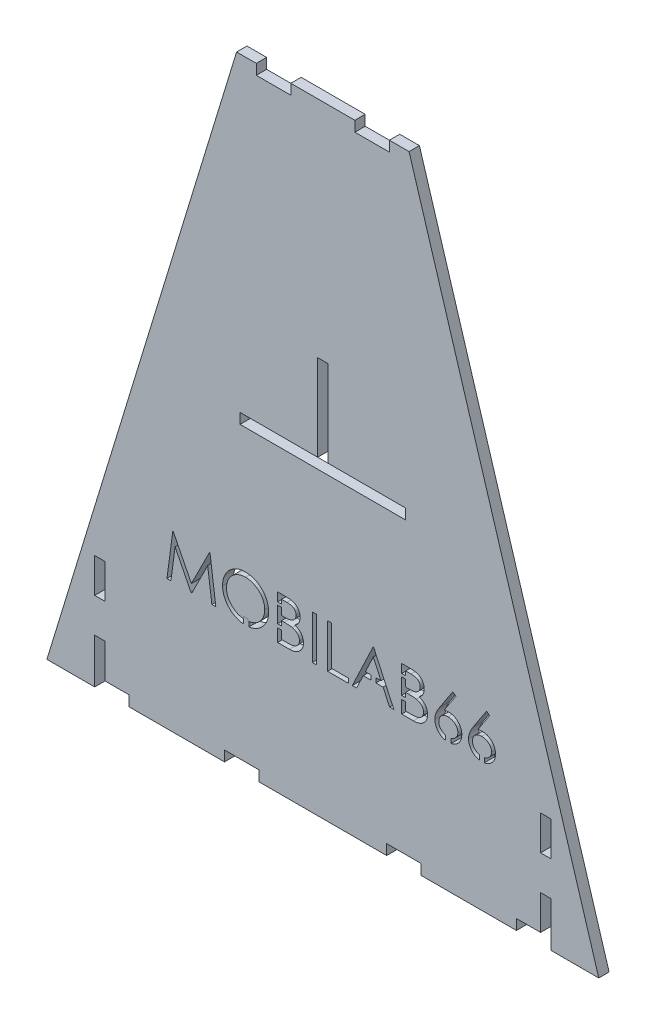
SolidWorks part; units mm, degrees
ref_plane "Plan de face" through (0, 0, 0) normal (0, 0, 1) x (1, 0, 0)
ref_plane "Plan de dessus" through (0, 0, 0) normal (0, 1, 0) x (1, 0, 0)
ref_plane "Plan de droite" through (0, 0, 0) normal (1, 0, 0) x (0, 0, -1)
sketch "Esquisse1" plane through (0, 0, 0) normal (0, 0, 1) x (1, 0, 0)
  line L0 (-80, 5) -> (-66.1305, 5)
  line L1 (-80, 5) -> (-25, 185)
  line L2 (-25, 185) -> (25, 185)
  line L3 (0, 0) -> (0, 132.8404) construction
  line L4 (-1.5, 120) -> (1.5, 120)
  line L5 (-1.5, 120) -> (-1.5, 95)
  line L6 (1.5, 95) -> (24, 95)
  line L7 (1.5, 120) -> (1.5, 95)
  line L8 (80, 5) -> (25, 185)
  line L9 (18.5112, 5) -> (18.5112, 8)
  line L10 (-24, 95) -> (-1.5, 95)
  line L11 (-24, 95) -> (-24, 92)
  line L12 (-24, 92) -> (24, 92)
  line L13 (24, 95) -> (24, 92)
  line L14 (-18.5112, 5) -> (18.5112, 5)
  line L15 (-66.1305, 5) -> (-66.1305, 8)
  line L16 (-66.1305, 8) -> (-56.1305, 8)
  line L17 (-56.1305, 5) -> (-56.1305, 8)
  line L18 (28.5112, 5) -> (56.1305, 5)
  line L19 (-28.5112, 5) -> (-28.5112, 8)
  line L20 (-28.5112, 8) -> (-18.5112, 8)
  line L21 (-18.5112, 5) -> (-18.5112, 8)
  line L22 (28.5112, 8) -> (18.5112, 8)
  line L23 (28.5112, 5) -> (28.5112, 8)
  line L24 (66.1305, 5) -> (80, 5)
  line L25 (56.1305, 5) -> (56.1305, 8)
  line L26 (66.1305, 8) -> (56.1305, 8)
  line L27 (66.1305, 5) -> (66.1305, 8)
  line L29 (-56.1305, 5) -> (-28.5112, 5)
  circle A0 centre (0, 94.0433) radius 26 construction
  circle A1 centre (0, 94.0433) radius 75 construction
  point P15 (0, 185)
  dimension "D7" = 52
  dimension "D8" = 150
  dimension "D1" = 3
  dimension "D2" = 25
  dimension "D3" = 115
  dimension "D4" = 160
  dimension "D5" = 180
  dimension "D6" = 50
  dimension "D9" = 3
  dimension "D10" = 48
  dimension "D11" = 10
  dimension "D12" = 3
extrude "Boss.-Extru.1" add sketch "Esquisse1" along normal blind 3
sketch "Esquisse2" plane through (0, 0, 3) normal (0, 0, 1) x (1, 0, 0)
  line L0 (0, 0) -> (0, 132.8404) construction
  line L1 (-63.1305, 8) -> (-66.1305, 8)
  line L2 (-63.1305, 8) -> (-63.1305, 18)
  line L3 (-63.1305, 18) -> (-66.1305, 18)
  line L4 (-66.1305, 8) -> (-66.1305, 18)
  line L5 (-66.1305, 28) -> (-63.1305, 28)
  line L6 (-66.1305, 28) -> (-66.1305, 38)
  line L7 (-66.1305, 38) -> (-63.1305, 38)
  line L8 (-63.1305, 28) -> (-63.1305, 38)
  line L9 (0, 0) -> (0, 132.8404) construction
  line L10 (63.1305, 28) -> (63.1305, 38)
  line L11 (66.1305, 38) -> (63.1305, 38)
  line L12 (66.1305, 28) -> (66.1305, 38)
  line L13 (66.1305, 28) -> (63.1305, 28)
  line L14 (66.1305, 8) -> (66.1305, 18)
  line L15 (63.1305, 18) -> (66.1305, 18)
  line L16 (63.1305, 8) -> (63.1305, 18)
  line L17 (63.1305, 8) -> (66.1305, 8)
  dimension "D1" = 3
  dimension "D2" = 10
  dimension "D3" = 10
  dimension "D4" = 3
  dimension "D5" = 10
extrude "Enlèv. mat.-Extru.1" cut sketch "Esquisse2" against normal through all
sketch "Esquisse3" plane through (0, 0, 3) normal (0, 0, 1) x (1, 0, 0)
  line L0 (-25, 185) -> (25, 185) construction
  line L1 (-19.29, 185) -> (-9.29, 185)
  line L2 (-19.29, 185) -> (-19.29, 182)
  line L3 (-19.29, 182) -> (-9.29, 182)
  line L4 (-9.29, 185) -> (-9.29, 182)
  line L5 (0, 185) -> (0, 174.1187) construction
  line L6 (9.29, 185) -> (9.29, 182)
  line L7 (19.29, 182) -> (9.29, 182)
  line L8 (19.29, 185) -> (19.29, 182)
  line L9 (19.29, 185) -> (9.29, 185)
  dimension "D1" = 3
  dimension "D2" = 10
extrude "Enlèv. mat.-Extru.2" cut sketch "Esquisse3" against normal blind 120
sketch "Esquisse4" plane through (0, 0, 3) normal (0, 0, 1) x (1, 0, 0)
  text T0 "MOBILAB66" font "Century Gothic" height in points 48
extrude "Enlèv. mat.-Extru.3" cut sketch "Esquisse4" against normal blind 3
sketch "Esquisse5" plane through (0, 0, 3) normal (0, 0, 1) x (1, 0, 0)
  line L0 (-13.1113, 42.6998) -> (-13.1113, 55.3998) construction
  line L1 (-13.1113, 52.8878) -> (-11.9716, 52.8878)
  line L2 (-13.1113, 52.8878) -> (-13.1113, 52.062)
  line L3 (-13.1113, 52.062) -> (-11.9716, 52.062)
  line L4 (-11.9716, 52.8878) -> (-11.9716, 52.062)
  line L5 (-11.9716, 54.0973) -> (-11.9716, 50.0268) construction
  line L6 (-11.9716, 48.7242) -> (-11.9716, 44.0024) construction
  line L7 (-11.9716, 46.3633) -> (-13.1113, 46.3633)
  line L8 (-11.9716, 46.3633) -> (-11.9716, 47.3929)
  line L9 (-11.9716, 47.3929) -> (-13.1113, 47.3929)
  line L10 (-13.1113, 46.3633) -> (-13.1113, 47.3929)
  line L11 (24.0117, 54.0973) -> (24.0117, 50.0268) construction
  line L12 (24.0117, 52.062) -> (22.872, 52.062)
  line L13 (24.0117, 52.062) -> (24.0117, 52.8878)
  line L14 (24.0117, 52.8878) -> (22.872, 52.8878)
  line L15 (22.872, 52.062) -> (22.872, 52.8878)
  line L16 (22.872, 42.6998) -> (22.872, 55.3998) construction
  line L17 (24.0117, 48.7242) -> (24.0117, 44.0024) construction
  line L18 (24.0117, 46.3633) -> (22.872, 46.3633)
  line L19 (24.0117, 46.3633) -> (24.0117, 47.3929)
  line L20 (24.0117, 47.3929) -> (22.872, 47.3929)
  line L21 (22.872, 46.3633) -> (22.872, 47.3929)
  line L22 (12.337, 48.0729) -> (16.8756, 48.0729) construction
  line L23 (13.9447, 48.0729) -> (15.3871, 48.0729)
  line L24 (13.9447, 48.0729) -> (13.9447, 46.7704)
  line L25 (13.9447, 46.7704) -> (15.3871, 46.7704)
  line L26 (15.3871, 48.0729) -> (15.3871, 46.7704)
  line L27 (17.476, 46.7704) -> (11.7188, 46.7704) construction
  line L29 (35.5561, 44.0024) -> (37.1962, 44.0024)
  line L30 (35.5561, 44.0024) -> (35.5561, 41.4914)
  line L31 (35.5561, 41.4914) -> (37.1962, 41.4914)
  line L32 (37.1962, 44.0024) -> (37.1962, 41.4914)
  line L33 (45.4531, 44.0024) -> (46.8104, 44.0024)
  line L34 (45.4531, 44.0024) -> (45.4531, 41.4914)
  line L35 (45.4531, 41.4914) -> (46.8104, 41.4914)
  line L36 (46.8104, 44.0024) -> (46.8104, 41.4914)
  line L37 (-23.0227, 44.3345) -> (-21.4216, 44.3345)
  line L38 (-23.0227, 44.3345) -> (-23.0227, 41.4914)
  line L39 (-23.0227, 41.4914) -> (-21.4216, 41.4914)
  line L40 (-21.4216, 44.3345) -> (-21.4216, 41.4914)
extrude "Boss.-Extru.2" add sketch "Esquisse5" against normal blind 3
